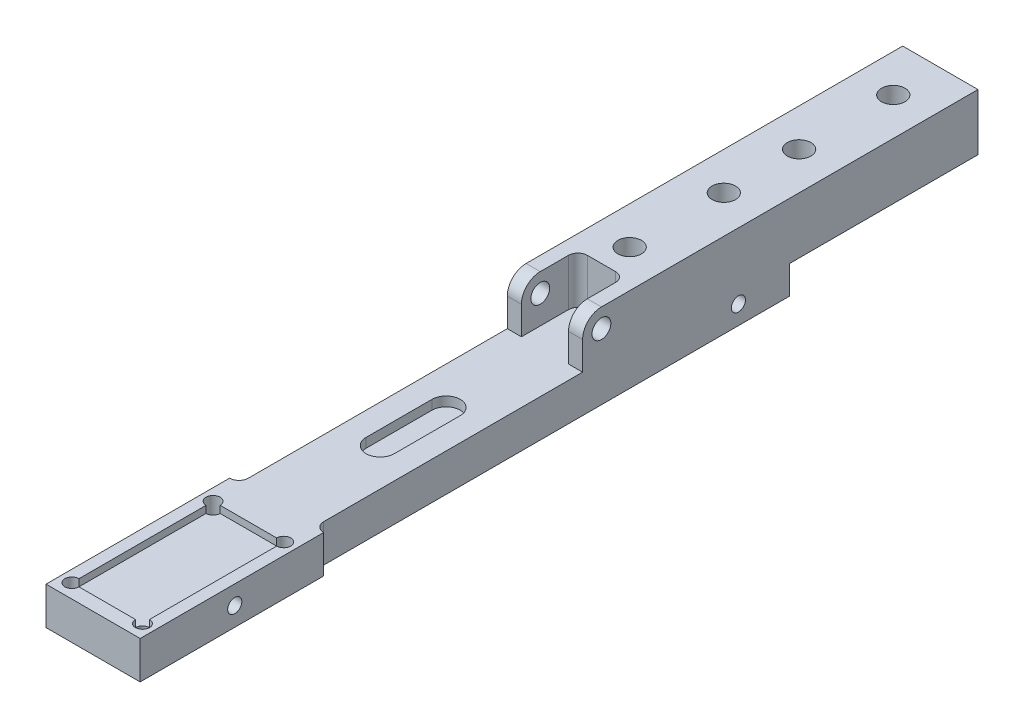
SolidWorks part; units mm, degrees
ref_plane "Front Plane" through (0, 0, 0) normal (0, 0, 1) x (1, 0, 0)
ref_plane "Top Plane" through (0, 0, 0) normal (0, 1, 0) x (1, 0, 0)
ref_plane "Right Plane" through (0, 0, 0) normal (1, 0, 0) x (0, 0, -1)
sketch "Sketch1" plane through (0, 0, 0) normal (1, 0, 0) x (0, 0, -1)
  line L1 (40, -8) -> (-100, -8)
  line L2 (40, -8) -> (40, -14)
  line L3 (40, -14) -> (-100, -14)
  line L4 (-100, -8) -> (-100, -14)
  dimension "D1" = 8
  dimension "D2" = 6
  dimension "D3" = 100
  dimension "D4" = 40
extrude "Boss-Extrude1" add sketch "Sketch1" along normal mid plane 20
sketch "Sketch2" plane through (0, 0, 0) normal (1, 0, 0) x (0, 0, -1)
  line L0 (40, -8) -> (-100, -8) construction
  line L1 (-4, -8) -> (4, -8)
  line L2 (-4, -8) -> (-4, 0)
  line L3 (0, 4) -> (40, 4)
  line L4 (4, -8) -> (40, -8)
  line L5 (40, -8) -> (40, 4)
  circle A0 centre (0, 0) radius 2
  arc A1 (-4, 0) -> (0, 4) centre (0, 0) cw
  dimension "D1" = 4
  dimension "D4" = 8
  dimension "D2" = 12
  dimension "D3" = 4
extrude "Boss-Extrude2" add sketch "Sketch2" along normal mid plane 20
sketch "Sketch6" plane through (0, 0, 4) normal (0, 0, 1) x (1, 0, 0)
  line L0 (10, 4) -> (-10, 4) construction
  line L1 (-10, -8) -> (-8, -8)
  line L2 (-10, -8) -> (-10, 4)
  line L3 (-10, 4) -> (-8, 4)
  line L4 (-8, -8) -> (-8, 4)
  line L5 (0, 0) -> (0, -14.5708) construction
  line L6 (10, -8) -> (8, -8)
  line L7 (8, -8) -> (8, 4)
  line L8 (10, 4) -> (8, 4)
  line L9 (10, -8) -> (10, 4)
  dimension "D1" = 2
extrude "Cut-Extrude3" cut sketch "Sketch6" against normal through all
sketch "Sketch7" plane through (0, 4, 0) normal (0, 1, 0) x (1, 0, 0)
  line L0 (8, -4) -> (-8, -4) construction
  line L1 (-5, -4) -> (5, -4)
  line L2 (-5, -4) -> (-5, 6)
  line L3 (-3, 8) -> (3, 8)
  line L4 (5, -4) -> (5, 6)
  arc A0 (-5, 6) -> (-3, 8) centre (-3, 6) cw
  arc A1 (5, 6) -> (3, 8) centre (3, 6) ccw
  dimension "D3" = 10
  dimension "D4" = 2
  dimension "D1" = 10
  dimension "D2" = 5
extrude "Cut-Extrude4" cut sketch "Sketch7" against normal blind 10
sketch "Sketch8" plane through (0, 0, 4) normal (0, 0, 1) x (1, 0, 0)
  line L0 (8, 0) -> (8, -8) construction
  line L1 (-8, -8) -> (8, -8)
  line L2 (-8, -8) -> (-8, -6)
  line L3 (-8, -6) -> (8, -6)
  line L4 (8, -8) -> (8, -6)
  dimension "D1" = 2
extrude "Boss-Extrude3" add sketch "Sketch8" along normal blind 15
sketch "Sketch9" plane through (0, 0, 19) normal (0, 0, 1) x (1, 0, 0)
  line L0 (-10, -6) -> (10, -6)
  line L1 (-10, -8) -> (10, -8)
  line L6 (-10, -6) -> (-10, -8)
  line L10 (10, -6) -> (10, -8)
  dimension "D1" = 2
extrude "Boss-Extrude4" add sketch "Sketch9" along normal blind 81
sketch "Sketch11" plane through (0, -8, 0) normal (0, 1, 0) x (1, 0, 0)
  line L0 (-10, -59) -> (-10, -61)
  line L1 (10, 40) -> (8, 40)
  line L2 (10, 40) -> (10, -59)
  line L4 (8, 40) -> (8, -59)
  line L5 (-10, 40) -> (-8, 40)
  line L6 (-10, 40) -> (-10, -59)
  line L7 (10, -59) -> (10, -61)
  line L8 (-8, 40) -> (-8, -59)
  arc A0 (-10, -61) -> (-8, -59) centre (-10, -59) ccw
  arc A1 (8, -59) -> (10, -61) centre (10, -59) ccw
  dimension "D1" = 2
  dimension "D2" = 2
  dimension "D3" = 99
  dimension "D4" = 99
extrude "Cut-Extrude6" cut sketch "Sketch11" against normal through all both and the other way through all
sketch "Sketch12" plane through (0, 0, -40) normal (0, 0, -1) x (-1, 0, 0)
  line L1 (-8, 4) -> (-8, -14) construction
  line L2 (8, 4) -> (-8, 4)
  line L3 (8, 4) -> (8, -8)
  line L4 (8, -8) -> (-8, -8)
  line L6 (-8, 4) -> (-8, -8)
  dimension "D1" = 12
extrude "Boss-Extrude5" add sketch "Sketch12" along normal blind 40
sketch "Sketch13" plane through (0, -6, 0) normal (0, 1, 0) x (1, 0, 0)
  line L0 (0, 0) -> (0, -110.9595) construction
  line L1 (10, -100) -> (10, -61) construction
  line L2 (10, -100) -> (-10, -100) construction
  circle A0 centre (7.5, -97) radius 1.5
  circle A1 centre (7.5, -67) radius 1.5
  circle A2 centre (-7.5, -67) radius 1.5
  circle A3 centre (-7.5, -97) radius 1.5
  dimension "D1" = 3
  dimension "D2" = 3
  dimension "D3" = 30
  dimension "D4" = 2.5
  dimension "D5" = 3
  dimension "D6" = 2.5
extrude "Cut-Extrude7" cut sketch "Sketch13" against normal through all
sketch "Sketch14" plane through (0, -6, 0) normal (0, 1, 0) x (1, 0, 0)
  line L1 (-7.5, -67) -> (7.5, -67)
  line L2 (-7.5, -67) -> (-7.5, -97)
  line L3 (-7.5, -97) -> (7.5, -97)
  line L4 (7.5, -67) -> (7.5, -97)
extrude "Cut-Extrude8" cut sketch "Sketch14" against normal blind 1.5
sketch "Sketch15" plane through (0, -6, 0) normal (0, 1, 0) x (1, 0, 0)
  line L0 (0, 0) -> (0, -108.5535) construction
  line L1 (10, -100) -> (-10, -100) construction
  line L2 (3, -25) -> (3, -39)
  line L3 (-3, -25) -> (-3, -39)
  arc A0 (-3, -39) -> (3, -39) centre (0, -39) ccw
  arc A1 (3, -25) -> (-3, -25) centre (0, -25) ccw
  dimension "D3" = 6
  dimension "D4" = 6
  dimension "D1" = 61
  dimension "D2" = 14
extrude "Cut-Extrude9" cut sketch "Sketch15" against normal blind 2
sketch "Sketch16" plane through (0, -14, 0) normal (0, -1, 0) x (1, 0, 0)
  line L0 (0, 0) -> (0, 106.7596) construction
  line L1 (10, 100) -> (-10, 100) construction
  circle A0 centre (0, -34) radius 2.5
  circle A1 centre (0, -14) radius 2.5
  dimension "D2" = 5
  dimension "D3" = 5
  dimension "D1" = 20
  dimension "D4" = 114
extrude "Cut-Extrude10" cut sketch "Sketch16" against normal through all
sketch "Sketch17" plane through (0, -8, 0) normal (0, -1, 0) x (1, 0, 0)
  line L0 (0, 0) -> (0, -86.9839) construction
  line L1 (8, -80) -> (-8, -80) construction
  circle A0 centre (0, -70) radius 2.5
  circle A1 centre (0, -50) radius 2.5
  dimension "D1" = 5
  dimension "D2" = 5
  dimension "D3" = 10
  dimension "D4" = 20
extrude "Cut-Extrude11" cut sketch "Sketch17" against normal through all
sketch "Sketch18" plane through (8, 0, 0) normal (1, 0, 0) x (0, 0, -1)
  line L0 (40, -14) -> (-59, -14) construction
  circle A0 centre (29.1, -10) radius 1.5
  dimension "D1" = 3
  dimension "D2" = 4
  dimension "D3" = 29.1
extrude "Cut-Extrude12" cut sketch "Sketch18" against normal blind 15
sketch "Sketch19" plane through (10, 0, 0) normal (1, 0, 0) x (0, 0, -1)
  line L0 (-100, -14) -> (-61, -14) construction
  circle A0 centre (-79.9, -10) radius 1.5
  dimension "D2" = 3
  dimension "D1" = 4
  dimension "D3" = 79.9
extrude "Cut-Extrude13" cut sketch "Sketch19" against normal blind 15
